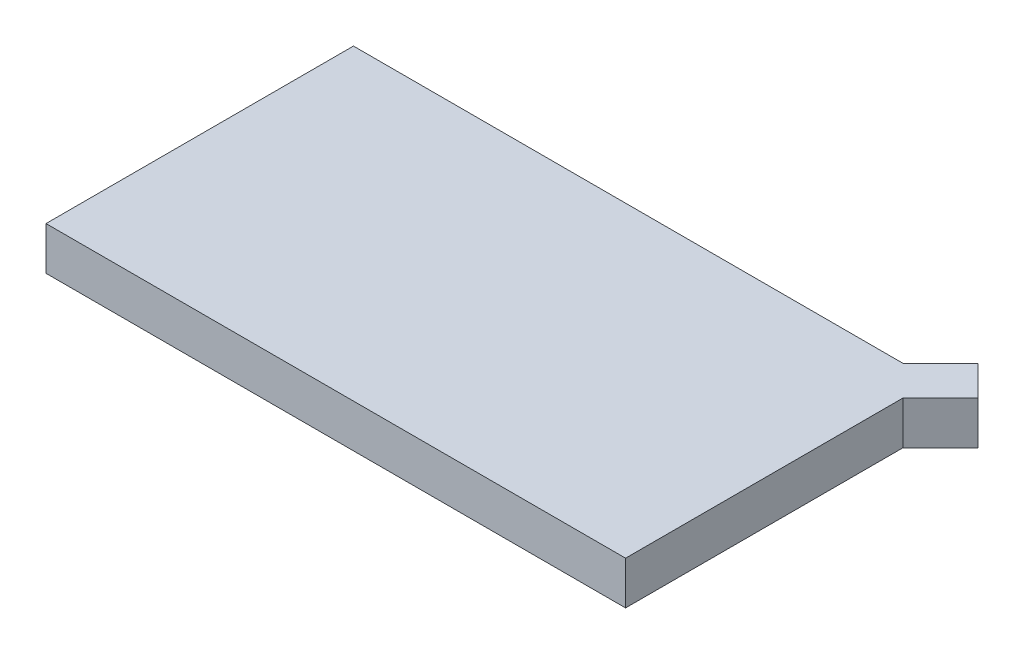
SolidWorks part; units mm, degrees
ref_plane "Piano frontale" through (0, 0, 0) normal (0, 0, 1) x (1, 0, 0)
ref_plane "Piano superiore" through (0, 0, 0) normal (0, 1, 0) x (1, 0, 0)
ref_plane "Piano destro" through (0, 0, 0) normal (1, 0, 0) x (0, 0, -1)
sketch "Schizzo1" plane through (0, 0, 0) normal (0, 1, 0) x (1, 0, 0)
  line L0 (140, 0) -> (0, 0)
  line L2 (0, 70) -> (140, 70)
  line L3 (140, 70) -> (140, 0)
  line L6 (0, 0) -> (0, 70)
  dimension "D1" = 140
  dimension "D2" = 70
extrude "Estrusione-Estrusione1" add sketch "Schizzo1" along normal blind 7.2
sketch "Schizzo18" plane through (0, 0, 0) normal (0, -1, 0) x (1, 0, 0)
  line L0 (287.0674, 449.5727) -> (1435.7341, 449.5727) construction
  line L1 (103.4727, 111.8548) -> (516.806, 111.8548) construction
  spline S0 degree 3 poles (4.411, -67.1079) (4.8465, -57.4627) (4.4904, -44.9321) (4.8381, -30.0177) (5.9884, -23.4199) (7.9913, -15.9678) (11.4644, -8.374) (16.8953, -4.1943) (19.4416, -3.3235) knots 0 0 0 0 0.419898 0.546804 0.648911 0.710436 0.883827 1 1 1 1
  spline S1 degree 3 poles (19.4416, -3.3235) (19.8829, -3.2032) (20.1322, -3.1552) (22.5306, -3.1245) (24.3053, -3.1468) (25.0769, -4.279) (25.6677, -4.8964) knots 0 0 0 0 0.19176 0.47509 0.535928 1 1 1 1
  spline S2 degree 3 poles (25.6677, -4.8964) (26.1575, -5.6879) (27.2454, -6.7979) (28.7656, -9.5155) (28.7344, -11.7566) (29.0771, -13.2137) knots 0 0 0 0 0.302142 0.505951 1 1 1 1
  spline S3 degree 3 poles (29.0771, -13.2137) (28.937, -21.364) (29.7106, -29.5507) (28.9302, -37.69) knots 0 0 0 0 1 1 1 1
  spline S4 degree 3 poles (28.9302, -37.69) (29.1418, -37.7125) (29.9679, -37.6773) (29.9198, -38.4148) (29.4942, -38.8918) (28.963, -38.5775) (28.6792, -38.6688) knots 0 0 0 0 0.357743 0.535352 0.655195 1 1 1 1
  spline S5 degree 3 poles (28.6792, -38.6688) (28.722, -40.3414) (28.194, -43.4485) (27.6598, -49.3291) (27.4701, -55.1792) (26.9048, -61.8882) (26.2629, -65.8284) (26.3874, -68.1986) knots 0 0 0 0 0.168522 0.318322 0.597596 0.760729 1 1 1 1
  spline S6 degree 1 poles (26.3874, -68.1986) (25.2348, -68.1396) knots 0 0 1 1
  spline S7 degree 3 poles (25.2348, -68.1396) (25.1745, -65.8006) (25.4755, -61.3688) (25.5602, -55.2215) (26.3216, -47.7368) (26.6478, -42.3224) (27.3431, -38.6688) knots 0 0 0 0 0.236969 0.450582 0.623179 1 1 1 1
  spline S8 degree 1 poles (27.3431, -38.6688) (5.7982, -39.4885) knots 0 0 1 1
  spline S9 degree 1 poles (5.7982, -39.4885) (5.4513, -67.1079) knots 0 0 1 1
  spline S10 degree 1 poles (4.411, -67.1079) (5.4513, -67.1079) knots 0 0 1 1
  spline S11 degree 1 poles (5.7982, -38.196) (27.8056, -37.69) knots 0 0 1 1
  spline S12 degree 3 poles (5.7982, -38.196) (6.0766, -33.9237) (6.2135, -26.6266) (8.7543, -17.7519) (11.533, -11.3023) (14.9534, -7.5789) (18.8976, -4.5741) (20.0884, -4.497) (21.7467, -4.4705) knots 0 0 0 0 0.319108 0.532393 0.683616 0.827157 0.920779 1 1 1 1
  spline S13 degree 3 poles (21.7467, -4.4705) (22.4167, -4.4978) (23.8342, -4.437) (24.8214, -5.6085) (26.1347, -6.9557) (27.8685, -10.7046) (27.9926, -14.2798) (28.048, -16.982) knots 0 0 0 0 0.127849 0.206481 0.348264 0.466199 1 1 1 1
  spline S14 degree 1 poles (28.048, -16.982) (27.8056, -37.69) knots 0 0 1 1
  spline S15 degree 3 poles (34.9501, -65.6689) (34.8714, -66.2964) (36.244, -66.4479) (36.2615, -65.1775) (36.4392, -64.8274) knots 0 0 0 0 0.459177 1 1 1 1
  spline S16 degree 3 poles (36.4392, -64.8274) (36.7003, -62.1898) (37.4474, -56.073) (38.3612, -46.6732) (38.7237, -37.5005) (39.2543, -28.8631) (40.3861, -19.4952) (39.9224, -12.4472) (40.0989, -8.4128) knots 0 0 0 0 0.140542 0.326834 0.500614 0.627256 0.785808 1 1 1 1
  spline S17 degree 3 poles (40.0989, -8.4128) (40.7067, -9.7551) (42.288, -11.6855) (44.186, -13.6408) (45.326, -13.8256) knots 0 0 0 0 0.560835 1 1 1 1
  spline S18 degree 3 poles (45.326, -13.8256) (46.2911, -13.8462) (46.7213, -12.31) (48.0128, -10.884) (49.061, -8.5579) (50.6644, -7.3549) (51.5031, -6.3078) knots 0 0 0 0 0.240085 0.419221 0.589027 1 1 1 1
  spline S19 degree 3 poles (51.5031, -6.3078) (51.5857, -10.9851) (51.9439, -17.4655) (50.9735, -26.5283) (50.1634, -41.4291) (49.0317, -54.5291) (49.43, -65.0516) knots 0 0 0 0 0.238747 0.329564 0.464533 1 1 1 1
  spline S20 degree 3 poles (49.43, -65.0516) (49.6135, -65.2402) (49.5119, -66.1879) (50.6454, -66.1535) (50.7048, -65.1435) (50.5726, -64.8274) knots 0 0 0 0 0.402055 0.50799 1 1 1 1
  spline S21 degree 3 poles (50.5726, -64.8274) (51.5442, -57.0049) (50.6124, -46.5565) (51.5942, -33.2184) (52.0178, -26.597) (53.0687, -21.1144) (52.7582, -15.9304) (52.8422, -10.4211) (52.9392, -6.3516) (52.6176, -4.8964) knots 0 0 0 0 0.39204 0.520685 0.667928 0.723337 0.798508 0.925696 1 1 1 1
  spline S22 degree 3 poles (52.6176, -4.8964) (52.5156, -4.8821) (52.2406, -4.0696) (51.5931, -4.4893) (51.3295, -4.6645) (51.1031, -4.8964) knots 0 0 0 0 0.433179 0.56837 1 1 1 1
  spline S23 degree 3 poles (51.1031, -4.8964) (49.8614, -5.9627) (48.6364, -7.7974) (46.884, -9.9207) (46.2675, -11.36) (45.5146, -12.1136) (44.7226, -12.7516) (44.1043, -11.8506) (43.3787, -11.091) (42.548, -9.9044) (41.5755, -8.7096) (40.9026, -7.548) (40.4551, -6.6816) (40.0799, -5.9748) (40.4864, -5.2221) (39.9079, -4.9719) (39.4939, -5.1802) (39.2811, -5.7013) (38.8103, -6.4953) (38.9612, -7.6028) (38.9904, -9.8831) (38.7338, -11.7287) (38.8002, -13.2137) knots 0 0 0 0 0.175069 0.236886 0.297798 0.338206 0.357905 0.391834 0.426771 0.481523 0.543644 0.59455 0.62534 0.650121 0.678127 0.693256 0.70295 0.725633 0.751123 0.801753 0.83932 1 1 1 1
  spline S24 degree 3 poles (38.8002, -13.2137) (38.7782, -15.3373) (39.207, -18.6609) (38.7898, -23.3596) (38.4575, -26.6947) (37.9886, -30.4593) (37.8926, -34.1944) (37.1699, -38.398) (37.4141, -42.8452) (36.9375, -49.1562) (36.2464, -55.6234) (35.4882, -61.5804) (35.342, -64.3867) (34.9501, -65.6689) knots 0 0 0 0 0.121018 0.189327 0.268021 0.31204 0.405269 0.480497 0.553838 0.657858 0.840594 0.924219 1 1 1 1
  spline S25 degree 3 poles (57.8986, -66.5877) (57.7583, -66.654) (57.8359, -67.8588) (59.0139, -67.2211) (58.8118, -66.3919) (59.0864, -65.928) knots 0 0 0 0 0.347394 0.487284 1 1 1 1
  spline S26 degree 3 poles (59.0864, -65.928) (59.1545, -63.8927) (59.0117, -57.7272) (59.097, -51.5608) (59.0864, -47.4303) knots 0 0 0 0 0.330109 1 1 1 1
  spline S27 degree 3 poles (59.0864, -47.4303) (59.0873, -44.5956) (58.7997, -39.6308) (59.1627, -33.7776) (58.9991, -29.6759) (59.4897, -26.5692) (59.6923, -23.1067) (60.4643, -20.1145) (61.0164, -16.846) (62.1491, -13.7951) (63.8787, -9.9387) (65.5723, -6.8935) (68.0221, -5.5846) (69.6011, -5.8177) (71.2333, -5.5735) (73.2154, -6.3147) (74.4476, -8.0596) (75.3897, -9.8904) (76.1689, -11.652) (76.2216, -13.5526) (76.3432, -18.114) (76.0899, -28.1554) (75.5367, -37.5295) (75.9034, -43.6383) knots 0 0 0 0 0.097306 0.17033 0.201123 0.23779 0.277939 0.319866 0.343481 0.391636 0.43052 0.48994 0.505723 0.521682 0.543112 0.561814 0.590799 0.613428 0.633228 0.655942 0.677792 0.790291 1 1 1 1
  spline S28 degree 3 poles (75.9034, -43.6383) (73.7014, -43.609) (70.3839, -43.628) (64.8801, -43.9684) (61.6383, -44.861) (59.7992, -46.1498) knots 0 0 0 0 0.399622 0.60195 1 1 1 1
  spline S29 degree 3 poles (59.7992, -46.1498) (59.4552, -46.1881) (59.2047, -46.7799) (59.8255, -47.2729) (60.5771, -46.7747) (61.2654, -46.0692) (62.7534, -45.8951) (64.4226, -45.4935) (68.8343, -44.7148) (72.6892, -44.9147) (75.7495, -44.6666) knots 0 0 0 0 0.050576 0.077404 0.108508 0.185422 0.245884 0.351801 0.479875 1 1 1 1
  spline S30 degree 1 poles (75.7495, -44.6666) (75.7151, -66.4433) knots 0 0 1 1
  spline S31 degree 3 poles (75.7151, -66.4433) (76.0335, -67.4392) (77.0149, -66.3426) (77.1269, -65.928) knots 0 0 0 0 1 1 1 1
  spline S32 degree 1 poles (77.1269, -65.928) (76.938, -44.6666) knots 0 0 1 1
  spline S33 degree 3 poles (76.938, -44.6666) (77.061, -37.8532) (77.3803, -31.0439) (77.3954, -24.2285) knots 0 0 0 0 1 1 1 1
  spline S34 degree 3 poles (77.3954, -24.2285) (77.2535, -20.1715) (77.6358, -16.1028) (77.1442, -12.0578) knots 0 0 0 0 1 1 1 1
  spline S35 degree 3 poles (77.1442, -12.0578) (76.7216, -10.7896) (76.2867, -8.6994) (73.9754, -5.9323) (72.1131, -4.5595) (70.482, -4.555) knots 0 0 0 0 0.380124 0.570312 1 1 1 1
  spline S36 degree 1 poles (70.482, -4.555) (68.0395, -4.6114) knots 0 0 1 1
  spline S37 degree 3 poles (68.0395, -4.6114) (67.0176, -4.934) (65.4962, -6.0441) (63.2021, -8.7907) (59.2815, -15.3507) (58.3004, -22.3258) (57.8986, -27.2988) knots 0 0 0 0 0.1225 0.213781 0.413644 1 1 1 1
  spline S38 degree 3 poles (57.8986, -27.2988) (57.389, -32.2854) (57.5302, -41.122) (58.0187, -54.2122) (57.8575, -62.3121) (57.8986, -66.5877) knots 0 0 0 0 0.382024 0.673578 1 1 1 1
  spline S39 degree 3 poles (86.3959, -12.0578) (86.009, -12.3773) (86.9495, -13.2836) (87.2708, -12.0773) (87.4766, -11.1891) (88.211, -9.8073) (88.9922, -8.6075) (90.548, -7.4566) (92.4222, -6.5086) (95.5334, -5.3146) (98.5963, -5.3072) (101.0123, -5.051) (102.2797, -5.4428) (102.7089, -6.5569) (103.1113, -7.9225) (103.3325, -11.0196) (103.5575, -14.1631) (102.7713, -17.7317) (101.355, -21.0537) (97.8036, -25.5243) (93.4519, -29.1478) (89.9497, -31.8849) (88.3552, -33.3517) (88.1828, -34.5497) (88.6497, -35.041) (89.3809, -35.2712) (90.0722, -35.8757) (91.248, -36.4771) (92.2029, -37.6538) (93.7023, -39.1416) (94.7142, -41.3436) (96.6481, -43.7721) (97.5209, -46.5617) (98.9789, -49.7269) (101.1017, -55.1573) (103.1879, -59.7774) (104.4005, -63.0941) knots 0 0 0 0 0.012809 0.019115 0.033144 0.04754 0.070676 0.081383 0.112794 0.141979 0.19375 0.214839 0.225499 0.235076 0.253028 0.274719 0.339821 0.359077 0.398442 0.461396 0.551236 0.589018 0.615098 0.620831 0.627505 0.635805 0.646817 0.658133 0.680354 0.697318 0.729755 0.761409 0.801979 0.827722 0.880014 1 1 1 1
  spline S40 degree 3 poles (104.4005, -63.0941) (105.2826, -63.9393) (105.8443, -62.2198) (105.3417, -61.7255) knots 0 0 0 0 1 1 1 1
  spline S41 degree 3 poles (105.3417, -61.7255) (104.7112, -59.7046) (103.0341, -56.7552) (101.7143, -52.6259) (99.6676, -48.4177) (99.1218, -44.9831) (97.737, -42.8895) knots 0 0 0 0 0.311232 0.497087 0.638196 1 1 1 1
  spline S42 degree 3 poles (97.737, -42.8895) (97.0058, -41.2553) (95.4871, -39.1007) (92.7439, -36.147) (90.778, -35.0235) (89.6803, -34.1939) knots 0 0 0 0 0.443491 0.655299 1 1 1 1
  spline S43 degree 3 poles (89.6803, -34.1939) (91.6338, -32.252) (94.6916, -29.4633) (98.6574, -25.6348) (101.6852, -22.814) (103.1954, -19.1647) (104.3079, -16.7216) (104.2918, -15.4819) knots 0 0 0 0 0.341341 0.510264 0.68605 0.842635 1 1 1 1
  spline S44 degree 2 poles (104.2918, -15.4819) (104.246, -11.9474) (104.2002, -8.4128) knots 0 0 0 1 1 1
  spline S45 degree 3 poles (104.2002, -8.4128) (103.8746, -7.5384) (103.9646, -5.5814) (102.4041, -4.2325) (101.5263, -4.11) knots 0 0 0 0 0.520594 1 1 1 1
  spline S46 degree 1 poles (101.5263, -4.11) (95.6764, -4.2057) knots 0 0 1 1
  spline S47 degree 3 poles (95.6764, -4.2057) (94.5775, -4.3889) (92.6396, -5.0476) (90.0606, -6.4089) (87.5674, -8.4877) (86.5265, -10.6326) (86.3959, -12.0578) knots 0 0 0 0 0.25711 0.471755 0.672719 1 1 1 1
  spline S48 degree 3 poles (84.518, -7.3836) (84.7644, -14.744) (84.9785, -27.1827) (85.9056, -43.3583) (86.8961, -55.9995) (87.6603, -63.5839) (87.532, -67.4398) knots 0 0 0 0 0.36733 0.62043 0.807889 1 1 1 1
  spline S49 degree 3 poles (87.532, -67.4398) (87.5139, -67.9203) (88.523, -68.32) (89.0333, -67.2403) (88.9298, -66.5723) (88.6296, -66.1357) knots 0 0 0 0 0.412794 0.538365 1 1 1 1
  spline S50 degree 3 poles (88.6296, -66.1357) (88.8276, -61.9306) (88.2826, -54.8678) (87.9006, -46.5875) (87.5125, -40.8592) (86.9859, -34.8781) (87.2232, -28.589) (86.0171, -19.259) (86.0593, -12.9899) (85.6745, -8.2307) knots 0 0 0 0 0.21701 0.36631 0.428753 0.514008 0.676764 0.752933 1 1 1 1
  spline S51 degree 3 poles (84.518, -7.3836) (85.0067, -6.5501) (85.6578, -7.8264) (85.6745, -8.2307) knots 0 0 0 0 1 1 1 1
  spline S52 degree 3 poles (115.4723, -66.1357) (114.5499, -60.6602) (112.0974, -51.1212) (111.5519, -37.4873) (111.5074, -27.4479) (111.8864, -19.0139) (114.4309, -11.9868) (120.5782, -4.3639) (129.0611, -4.7929) (131.1743, -8.5949) knots 0 0 0 0 0.223411 0.393526 0.546164 0.627959 0.730567 0.843234 1 1 1 1
  spline S53 degree 3 poles (131.1743, -8.5949) (131.7135, -11.1628) (133.9013, -15.5231) (134.855, -22.3236) (134.9785, -28.8582) (134.5406, -33.1836) (134.6085, -35.5326) knots 0 0 0 0 0.285596 0.526081 0.743278 1 1 1 1
  spline S54 degree 3 poles (134.6085, -35.5326) (135.0485, -35.2805) (135.5637, -35.8643) (135.4678, -36.5476) (135.247, -37.098) (134.7805, -37.0254) (134.6085, -37.1697) knots 0 0 0 0 0.41749 0.619709 0.752833 1 1 1 1
  spline S55 degree 1 poles (134.6085, -37.1697) (134.4878, -62.604) knots 0 0 1 1
  spline S56 degree 3 poles (134.4878, -62.604) (134.5322, -63.1382) (133.6396, -63.4146) (132.7986, -63.1155) (132.8044, -62.604) knots 0 0 0 0 0.505445 1 1 1 1
  spline S57 degree 2 poles (132.8044, -62.604) (132.4612, -49.8906) (132.6772, -37.1697) knots 0 0 0 1 1 1
  spline S58 degree 3 poles (132.6772, -37.1697) (130.2665, -37.5526) (126.6385, -38.938) (120.1632, -39.3701) (116.5122, -41.2486) (113.9413, -41.6475) knots 0 0 0 0 0.379027 0.596977 1 1 1 1
  spline S59 degree 3 poles (113.9413, -41.6475) (114.0024, -43.697) (114.2808, -47.3002) (115.3564, -52.1235) (115.4664, -58.305) (116.0526, -62.8821) (116.5654, -66.1357) knots 0 0 0 0 0.249652 0.438794 0.599154 1 1 1 1
  spline S60 degree 3 poles (116.5654, -66.1357) (116.5796, -66.4358) (117.3177, -68.0003) (116.3071, -67.6015) knots 0 0 0 0 1 1 1 1
  spline S61 degree 1 poles (115.4723, -66.1357) (116.3071, -67.6015) knots 0 0 1 1
  spline S62 degree 3 poles (113.9413, -40.3524) (115.6697, -39.4536) (119.3411, -38.3677) (125.6541, -37.1342) (129.9799, -35.6086) (132.6772, -36.0574) knots 0 0 0 0 0.300898 0.590055 1 1 1 1
  spline S63 degree 3 poles (113.9413, -40.3524) (113.379, -36.9493) (113.1387, -31.7456) (113.1024, -25.7947) (113.2383, -22.1319) (113.8953, -18.9739) (115.406, -14.8825) (117.3772, -10.791) (121.8763, -7.6526) (125.1398, -6.2366) (127.6312, -7.1081) knots 0 0 0 0 0.249253 0.376503 0.430937 0.514361 0.608142 0.748608 0.830836 1 1 1 1
  spline S64 degree 3 poles (127.6312, -7.1081) (129.156, -8.1843) (130.533, -11.2409) (131.6865, -15.8612) (132.5425, -20.4545) (132.2139, -27.2509) (132.3694, -32.4793) (132.6772, -36.0574) knots 0 0 0 0 0.179504 0.323923 0.477332 0.642491 1 1 1 1
extrude "Estrusione-Estrusione14" add sketch "Schizzo18" along normal blind 0.38
scale "Scala1" scale about centroid uniform scaling no x scale factor 1.1 y scale factor 1 z scale factor 1.1
sketch "Schizzo20" plane through (0, 7.2, 0) normal (0, 1, 0) x (1, 0, 0)
  line L8 (-12.0019, 78.5004) -> (-12.0019, -8.4996)
  line L9 (-12.0019, -8.4996) -> (151.9981, -8.4996)
  line L10 (151.9981, -8.4996) -> (151.9981, 78.5004)
  line L11 (151.9981, 78.5004) -> (-12.0019, 78.5004)
  line L12 (-12.0019, 78.5004) -> (-12.0019, -8.4996)
  line L13 (-12.0019, -8.4996) -> (151.9981, -8.4996)
  line L14 (151.9981, -8.4996) -> (151.9981, 78.5004)
  line L15 (151.9981, 78.5004) -> (-12.0019, 78.5004)
  dimension "D1" = 5
extrude "Estrusione-Estrusione15" add sketch "Schizzo20" along normal blind 3
sketch "Schizzo21" plane through (0, 7.2, 0) normal (0, -1, 0) x (1, 0, 0)
  line L4 (-12.0019, -78.5004) -> (151.9981, -78.5004)
  line L5 (151.9981, -78.5004) -> (151.9981, 8.4996)
  line L6 (151.9981, 8.4996) -> (-12.0019, 8.4996)
  line L7 (-12.0019, 8.4996) -> (-12.0019, -78.5004)
  line L8 (-12.0019, -78.5004) -> (151.9981, -78.5004)
  line L9 (151.9981, -78.5004) -> (151.9981, 8.4996)
  line L10 (151.9981, 8.4996) -> (-12.0019, 8.4996)
  line L11 (-12.0019, 8.4996) -> (-12.0019, -78.5004)
  dimension "D1" = 0
extrude "Estrusione-Sottile1" add sketch "Schizzo21" along normal offset from surface (9.2 mm away) 2 thin
sketch "Schizzo22" plane through (0, 10.2, 0) normal (0, 1, 0) x (1, 0, 0)
  line L0 (143.5128, 78.5004) -> (154.1194, 89.107)
  line L1 (151.9981, 78.5004) -> (-12.0019, 78.5004) construction
  line L2 (154.1194, 89.107) -> (162.6047, 80.6217)
  line L3 (162.6047, 80.6217) -> (151.9981, 70.0151)
  line L4 (151.9981, -8.4996) -> (151.9981, 78.5004) construction
  line L5 (143.5128, 78.5004) -> (151.9981, 78.5004)
  line L6 (151.9981, 78.5004) -> (151.9981, 70.0151)
  dimension "D1" = 9
  dimension "D2" = 12
extrude "Estrusione-Estrusione16" add sketch "Schizzo22" against normal up to surface (12.2 mm away)
sketch "Schizzo23" plane through (0, -2, 0) normal (0, -1, 0) x (1, 0, 0)
  line L0 (142.6341, -75.5004) -> (154.1194, -86.9857)
  line L1 (148.9981, -75.5004) -> (-9.0019, -75.5004) construction
  line L2 (154.1194, -86.9857) -> (160.4834, -80.6217)
  line L3 (160.4834, -80.6217) -> (148.9981, -69.1364)
  line L4 (148.9981, 5.4996) -> (148.9981, -75.5004) construction
  line L5 (148.9981, -69.1364) -> (148.9981, -75.5004)
  line L6 (148.9981, -75.5004) -> (148.9981, 5.4996) construction
  line L7 (148.9981, -75.5004) -> (142.6341, -75.5004)
  line L8 (162.6047, -80.6217) -> (151.9981, -70.0151) construction
  line L9 (154.1194, -89.107) -> (162.6047, -80.6217) construction
  dimension "D1" = 1.5
  dimension "D2" = 1.5
extrude "Taglio-Estrusione1" cut sketch "Schizzo23" against normal blind 2
sketch "Schizzo24" plane through (39.9308, 0, 39.9308) normal (-0.7071, 0, -0.7071) x (-0.7071, 0, 0.7071)
  line L0 (-170.487, -2) -> (-167.0229, 0)
  line L1 (-170.487, 0) -> (-154.2444, 0) construction
  line L2 (-167.0229, 0) -> (-170.487, 0)
  line L3 (-170.487, 0) -> (-170.487, -2)
  dimension "D1" = 30
extrude "Estrusione-Estrusione17" add sketch "Schizzo24" along normal up to next
